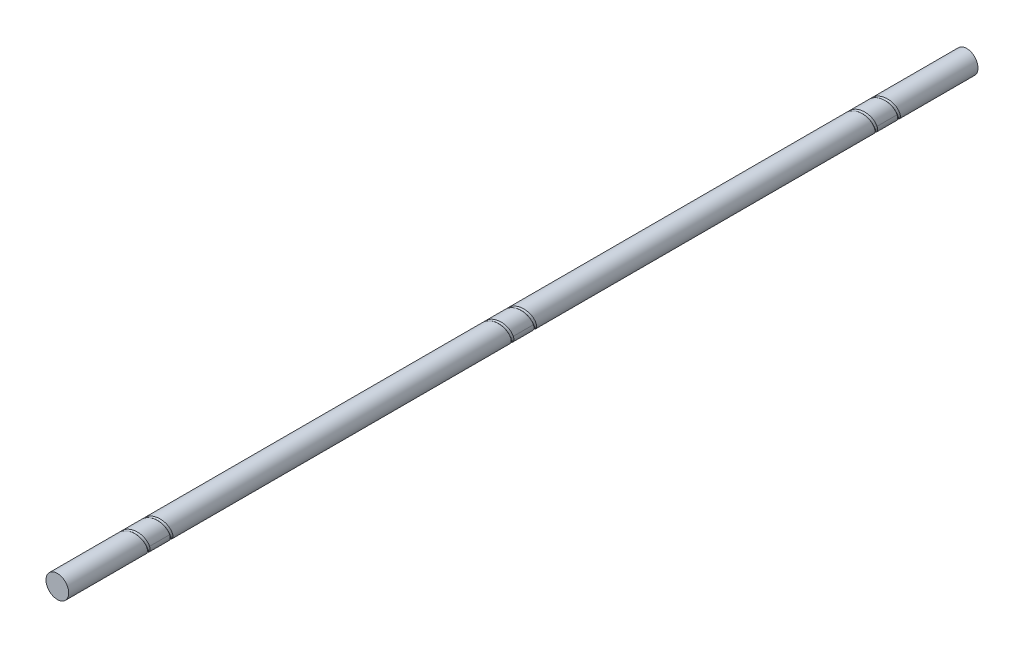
SolidWorks part; units mm, degrees
ref_plane "Front Plane" through (0, 0, 0) normal (0, 0, 1) x (1, 0, 0)
ref_plane "Top Plane" through (0, 0, 0) normal (0, 1, 0) x (1, 0, 0)
ref_plane "Right Plane" through (0, 0, 0) normal (1, 0, 0) x (0, 0, -1)
sketch "Sketch1" plane through (0, 0, 0) normal (0, 0, 1) x (1, 0, 0)
  circle A0 centre (0, 0) radius 25
  dimension "D1" = 50
extrude "Boss-Extrude1" add sketch "Sketch1" along normal blind 2000
ref_plane "Plane1" through (0, 0, 150) normal (0, 0, 1) x (1, 0, 0)
sketch "Sketch2" plane through (0, 0, 150) normal (0, 0, 1) x (1, 0, 0)
  circle A0 centre (0, 0) radius 27.646
  dimension "D1" = 55.292
curve "Helix/Spiral1"
sketch "Sketch3" plane through (0, 0, 0) normal (0, 1, 0) x (1, 0, 0)
  circle A0 centre (-27.646, -150) radius 3.969
  spline S0 degree 3 poles (-27.646, -150) (-27.646, -150.7073) (-26.9833, -152.1286) (-24.0718, -154.2551) (-19.4496, -156.383) (-13.4454, -158.5106) (-6.4857, -160.6383) (0.9349, -162.766) (8.289, -164.8936) (15.0541, -167.0213) (20.7495, -169.1489) (24.9703, -171.2766) (27.4167, -173.4043) (27.9149, -175.5319) (26.4293, -177.6596) (23.0657, -179.7872) (18.063, -181.9149) (11.7766, -184.0426) (4.6535, -186.1702) (-2.8004, -188.2979) (-10.0553, -190.4255) (-16.5956, -192.5532) (-21.9566, -194.6809) (-25.7573, -196.8085) (-27.7277, -198.9362) (-27.7277, -201.0638) (-25.7573, -203.1915) (-21.9566, -205.3191) (-16.5956, -207.4468) (-10.0553, -209.5745) (-2.8004, -211.7021) (4.6535, -213.8298) (11.7766, -215.9574) (18.063, -218.0851) (23.0657, -220.2128) (26.4293, -222.3404) (27.9149, -224.4681) (27.4167, -226.5957) (24.9703, -228.7234) (20.7495, -230.8511) (15.0541, -232.9787) (8.289, -235.1064) (0.9349, -237.234) (-6.4857, -239.3617) (-13.4454, -241.4894) (-19.4496, -243.617) (-24.0718, -245.7449) (-26.9833, -247.8714) (-27.646, -249.2927) (-27.646, -250) knots 0 0 0 0 0.021277 0.042553 0.06383 0.085106 0.106383 0.12766 0.148936 0.170213 0.191489 0.212766 0.234043 0.255319 0.276596 0.297872 0.319149 0.340426 0.361702 0.382979 0.404255 0.425532 0.446809 0.468085 0.489362 0.510638 0.531915 0.553191 0.574468 0.595745 0.617021 0.638298 0.659574 0.680851 0.702128 0.723404 0.744681 0.765957 0.787234 0.808511 0.829787 0.851064 0.87234 0.893617 0.914894 0.93617 0.957447 0.978723 1 1 1 1 construction
  dimension "D1" = 7.938
sweep "Cut-Sweep1" cut profiles "Sketch3" path "Helix/Spiral1"
pattern_linear "LPattern1" count 3 spacing 800 along (0, 0, -1) of "Cut-Sweep1"
